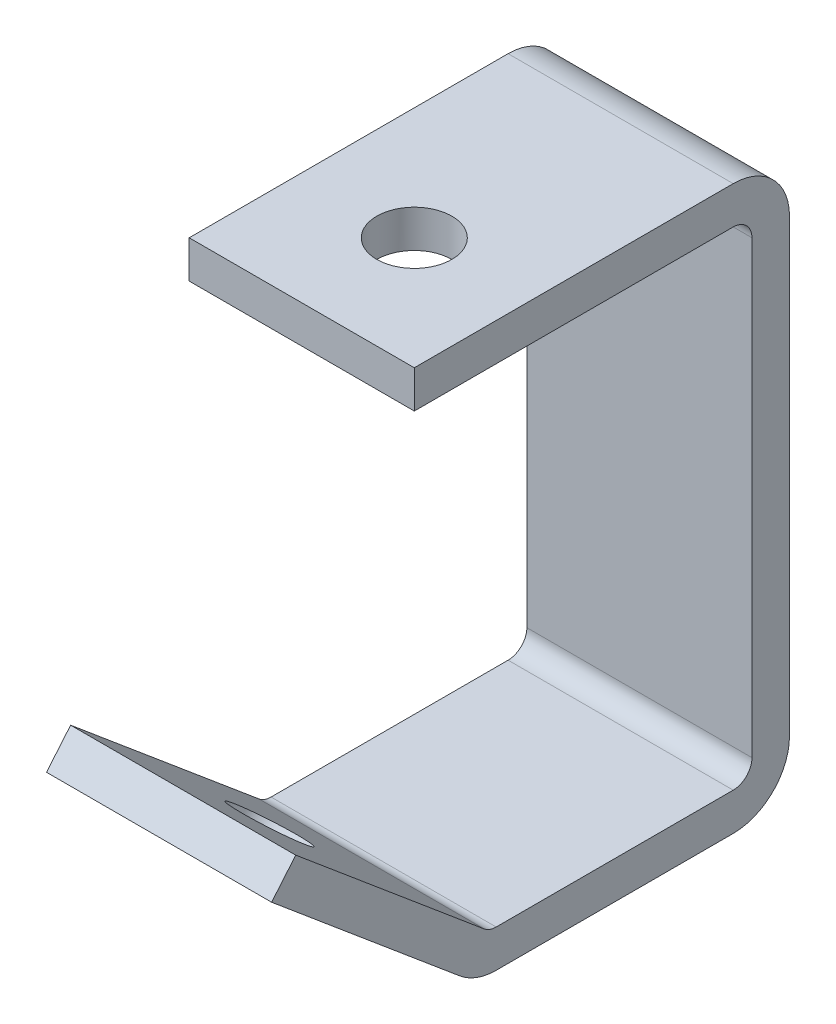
SolidWorks part; units mm, degrees
ref_plane "front" through (0, 0, 0) normal (0, 0, 1) x (1, 0, 0)
ref_plane "top" through (0, 0, 0) normal (0, 1, 0) x (1, 0, 0)
ref_plane "right" through (0, 0, 0) normal (1, 0, 0) x (0, 0, -1)
sketch "Sketch1" plane through (0, 0, 0) normal (1, 0, 0) x (0, 0, -1)
  line L0 (0, 0) -> (0, 82.55)
  line L1 (0, 82.55) -> (-57.15, 82.55)
  line L4 (-77.2165, 27.4943) -> (-44.45, 0)
  line L5 (-44.45, 0) -> (0, 0)
  dimension "D1" = 82.55
  dimension "D2" = 57.15
  dimension "D3" = 40
  dimension "D4" = 42.7736
  dimension "D5" = 44.45
extrude "Base-Extrude-Thin" add sketch "Sketch1" along normal mid plane 38.1 thin
sketch "Sketch2" plane through (0, 88.9, 0) normal (0, 1, 0) x (-1, 0, 0)
  line L0 (0, 50) -> (0, -50) construction
  line L1 (-19.05, 57.15) -> (19.05, 57.15) construction
  circle A0 centre (0, 38.1) radius 6.35
  dimension "D1" = 12.7
  dimension "D2" = 19.05
extrude "Cut-Extrude1" cut sketch "Sketch2" against normal up to next
sketch "Sketch3" plane through (0, -26.7517, 22.4474) normal (0, -0.766, 0.6428) x (1, 0, 0)
  circle A0 centre (0, 57.7582) radius 6 construction
  circle A1 centre (0, 57.7582) radius 6
extrude "Cut-Extrude2" cut sketch "Sketch3" against normal up to next
